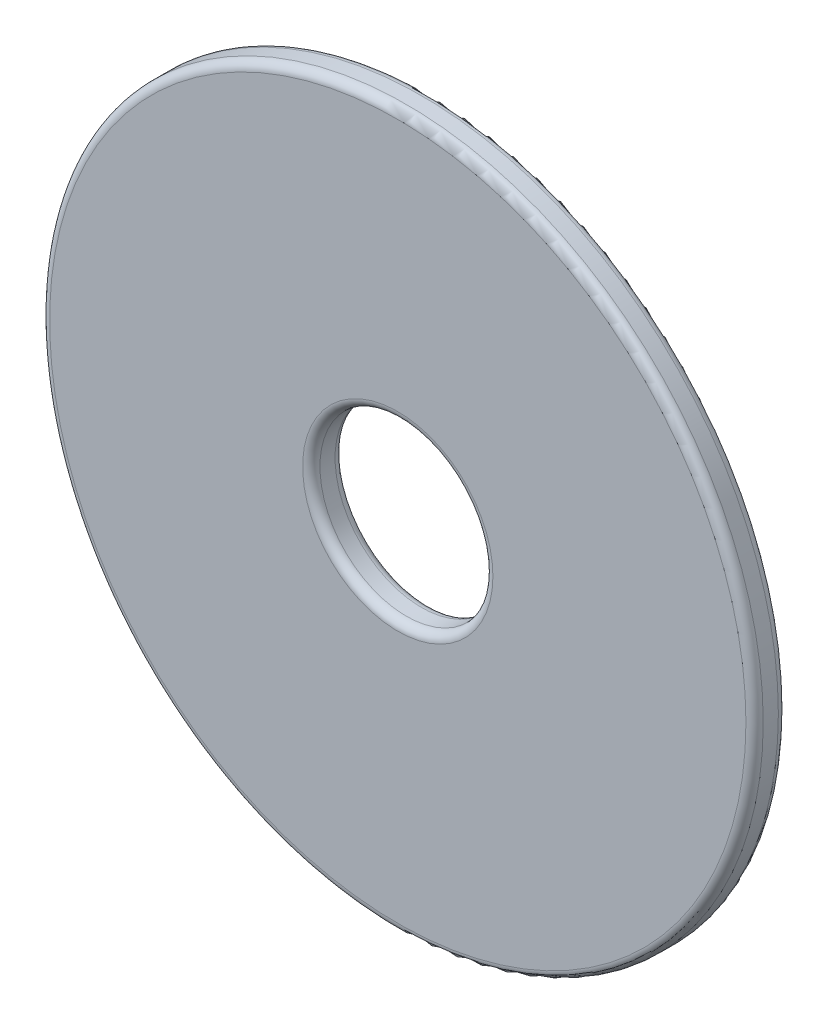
SolidWorks part; units mm, degrees
ref_plane "Face" through (0, 0, 0) normal (0, 0, 1) x (1, 0, 0)
ref_plane "Dessus" through (0, 0, 0) normal (0, 1, 0) x (1, 0, 0)
ref_plane "Droite" through (0, 0, 0) normal (1, 0, 0) x (0, 0, -1)
sketch "Esquisse1" plane through (0, 0, 0) normal (0, 0, 1) x (1, 0, 0)
  circle A0 centre (0, 0) radius 2
  circle A1 centre (0, 0) radius 8.25
  dimension "D1" = 4
  dimension "D2" = 16.5
extrude "Extrusion1" add sketch "Esquisse1" along normal blind 0.75
fillet "Congé1" radius 0.2
